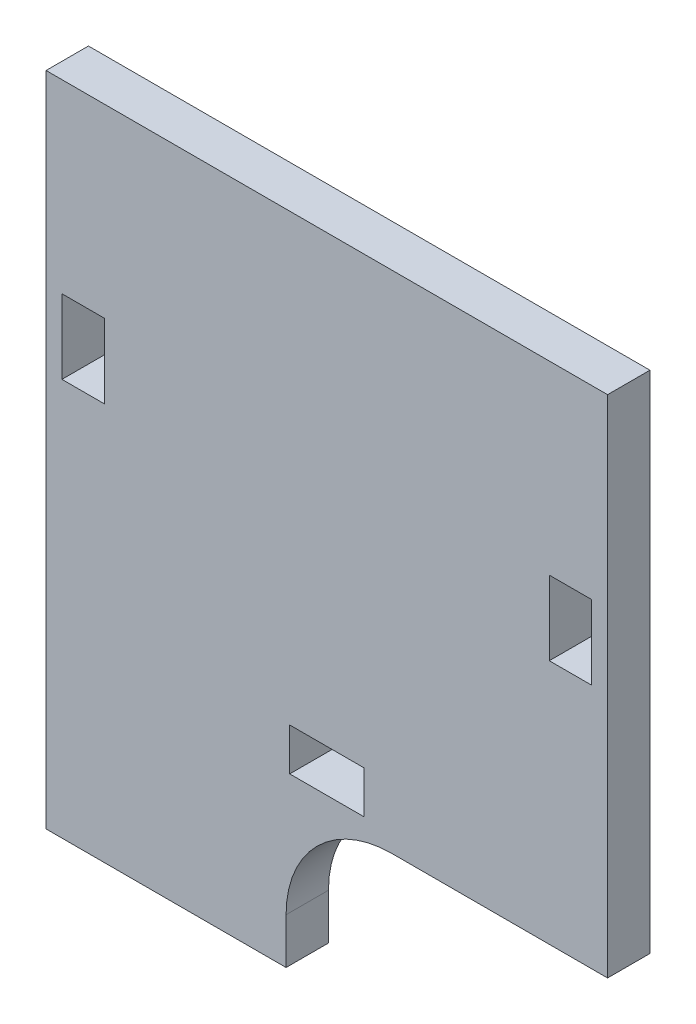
SolidWorks part; units mm, degrees
ref_plane "Front Plane" through (0, 0, 0) normal (0, 0, 1) x (1, 0, 0)
ref_plane "Top Plane" through (0, 0, 0) normal (0, 1, 0) x (1, 0, 0)
ref_plane "Right Plane" through (0, 0, 0) normal (1, 0, 0) x (0, 0, -1)
sketch "Sketch1" plane through (0, 0, 0) normal (0, 0, 1) x (1, 0, 0)
  line L0 (16.9511, -10.8647) -> (20.9511, -10.8647)
  line L1 (-30.5489, 6.6353) -> (22.4511, 6.6353)
  line L2 (-30.5489, 6.6353) -> (-30.5489, -55.3647)
  line L3 (-30.5489, -55.3647) -> (-7.7989, -55.3647)
  line L4 (22.4511, 6.6353) -> (22.4511, -55.3647)
  line L5 (-30.5489, 6.6353) -> (22.4511, -55.3647) construction
  line L6 (-30.5489, -55.3647) -> (22.4511, 6.6353) construction
  line L8 (-7.7989, -55.3647) -> (-7.7989, -55.3612)
  line L9 (-7.7989, -55.3612) -> (-0.2989, -55.3612)
  line L10 (-0.2989, -55.3647) -> (-0.2989, -55.3612)
  line L13 (-7.5489, -35.3647) -> (-0.5489, -35.3647)
  line L14 (-7.5489, -35.3647) -> (-7.5489, -39.3647)
  line L15 (-7.5489, -39.3647) -> (-0.5489, -39.3647)
  line L16 (-0.5489, -35.3647) -> (-0.5489, -39.3647)
  line L19 (-29.0489, -10.8647) -> (-25.0489, -10.8647)
  line L20 (-29.0489, -10.8647) -> (-29.0489, -17.8647)
  line L21 (-29.0489, -17.8647) -> (-25.0489, -17.8647)
  line L22 (-25.0489, -10.8647) -> (-25.0489, -17.8647)
  line L25 (16.9511, -10.8647) -> (16.9511, -17.8647)
  line L26 (16.9511, -17.8647) -> (20.9511, -17.8647)
  line L27 (20.9511, -10.8647) -> (20.9511, -17.8647)
  line L30 (-0.2989, -55.3647) -> (22.4511, -55.3647)
  point P0 (-4.0489, -24.3647)
  point P5 (-4.0489, -59.3647)
  point P11 (-27.0489, -10.8647)
  point P12 (-4.0489, -37.3647)
  point P19 (-27.0489, -14.3457)
  point P26 (18.9511, -14.3457)
  point P32 (-4.0489, -35.3647)
  dimension "D1" = 53
  dimension "D2" = 62
  dimension "D3" = 1.5
  dimension "D4" = 17.5
  dimension "D5" = 17.5
  dimension "D7" = 4.0489
extrude "Boss-Extrude3" add sketch "Sketch1" along normal blind 4 contours L10 L30 L4 L1 L2 L3 L8 L9 L0 L27 L26 L25 L19 L22 L21 L20 L13 L16 L15 L14
sketch "Sketch2" plane through (0, 0, 4) normal (0, 0, 1) x (1, 0, 0)
  line L1 (-7.8937, -41.0483) -> (22.8388, -41.0483)
  line L2 (-7.8937, -41.0483) -> (-7.8937, -55.5483)
  line L3 (-7.8937, -55.5483) -> (22.8388, -55.5483)
  line L4 (22.8388, -41.0483) -> (22.8388, -55.5483)
  line L5 (-30.5489, 6.6353) -> (-30.5489, -55.3647) construction
  dimension "D1" = 22.6552
extrude "Cut-Extrude1" cut sketch "Sketch2" against normal blind 10
fillet "Fillet1" radius 10 1 edges at (-7.8937, -41.0483, 2)
